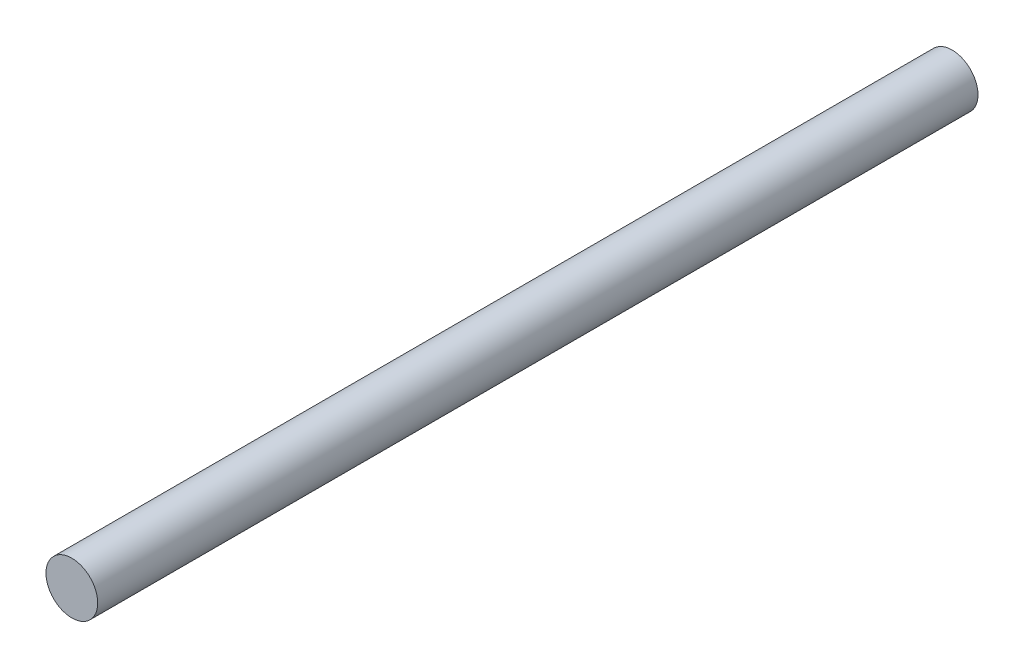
SolidWorks part; units mm, degrees
ref_plane "Front" through (0, 0, 0) normal (0, 0, 1) x (1, 0, 0)
ref_plane "Top" through (0, 0, 0) normal (0, 1, 0) x (1, 0, 0)
ref_plane "Right" through (0, 0, 0) normal (1, 0, 0) x (0, 0, -1)
sketch "Sketch1" plane through (0, 0, 0) normal (0, 0, 1) x (1, 0, 0)
  circle A0 centre (0, 0) radius 5
  dimension "D1" = 10
extrude "Extrude1" add sketch "Sketch1" along normal mid plane 170
